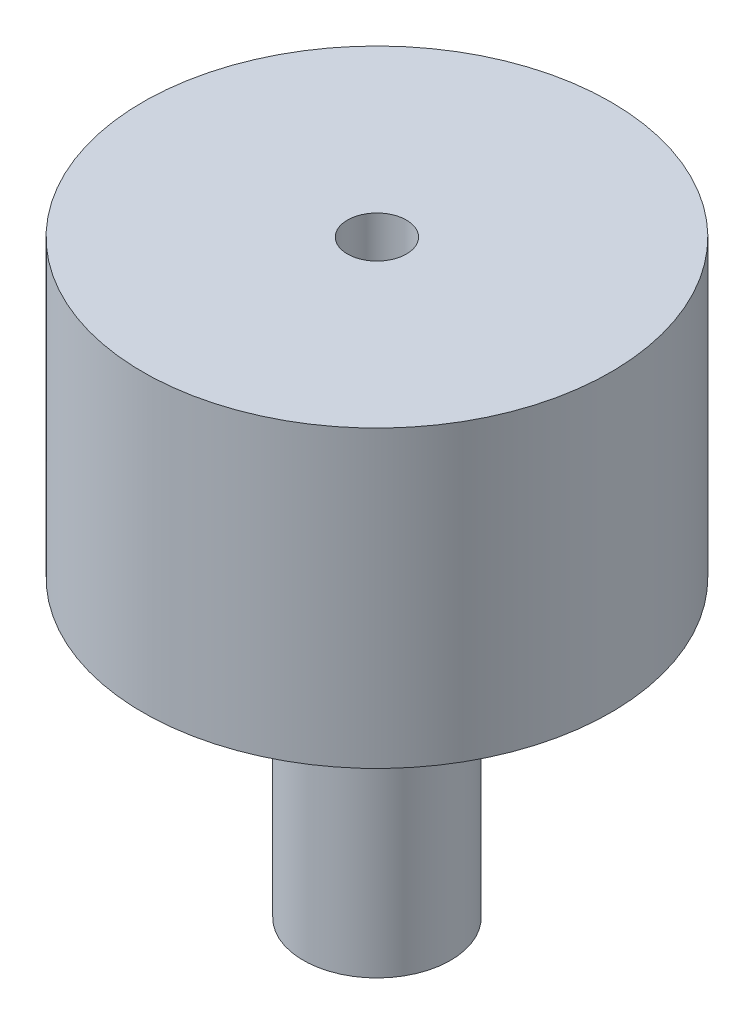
SolidWorks part; units mm, degrees
ref_plane "Front" through (0, 0, 0) normal (0, 0, 1) x (1, 0, 0)
ref_plane "Top" through (0, 0, 0) normal (0, 1, 0) x (1, 0, 0)
ref_plane "Right" through (0, 0, 0) normal (1, 0, 0) x (0, 0, -1)
ref_axis "Axis1" through (0, -50, 0) along (0, 1, 0)
sketch "Sketch1" plane through (0, 0, 0) normal (1, 0, 0) x (0, 0, -1)
  line L0 (0, 2) -> (-1.5875, 2)
  line L1 (-1.5875, 2) -> (-1.5875, 0)
  line L2 (-1.5875, 0) -> (-0.5, 0)
  line L3 (-0.5, 0) -> (-0.5, -2)
  line L4 (-0.5, -2) -> (0, -2)
  line L5 (0, -2) -> (0, 2)
  point P4 (0, 0)
  point P6 (0, 0)
  dimension "D1" = 4
  dimension "D2" = 2
  dimension "D3" = 1.5875
  dimension "D4" = 0.5
sketch "Sketch2" plane through (0, 0, 0) normal (1, 0, 0) x (0, 0, -1)
  line L6 (0, 2) -> (-1.5875, 2)
  line L7 (-1.5875, 2) -> (-1.5875, 0)
  line L8 (-1.5875, 0) -> (-0.5, 0)
  line L9 (-0.5, 0) -> (-0.5, -2)
  line L10 (-0.5, -2) -> (0, -2)
  line L11 (0, -2) -> (0, 2)
  line L12 (0, 2) -> (-1.5875, 2)
  line L13 (-1.5875, 2) -> (-1.5875, 0)
  line L14 (-1.5875, 0) -> (-0.5, 0)
  line L15 (-0.5, 0) -> (-0.5, -2)
  line L16 (-0.5, -2) -> (0, -2)
  line L17 (0, -2) -> (0, 2)
  dimension "D1" = 0
revolve "Revolve1" add sketch "Sketch2" angle 360 about axis through (0, -50, 0) along (0, 1, 0)
hole_wizard "Ø0.4 (0.4) Diameter Hole1" positions "Sketch3" profile "Sketch4" hole size "Ø0.4" standard "ANSI Metric"
sketch "Sketch3" plane through (0, 2, 0) normal (0, 1, 0) x (1, 0, 0)
  point P0 (0, 0)
sketch "Sketch4" plane through (0, 2, 0) normal (1, 0, 0) x (0, 0, 1)
  line L0 (0, 0) -> (0, 4)
  line L1 (0, 4) -> (0.2, 4)
  line L2 (0.2, 4) -> (0.2, 0)
  line L5 (0.2, 0) -> (0, 0)
  line L11 (0, -6.35) -> (0, 107.95) construction
  dimension "Thru Hole Dia." = 0.4
  dimension "Thru Hole Depth" = 4
